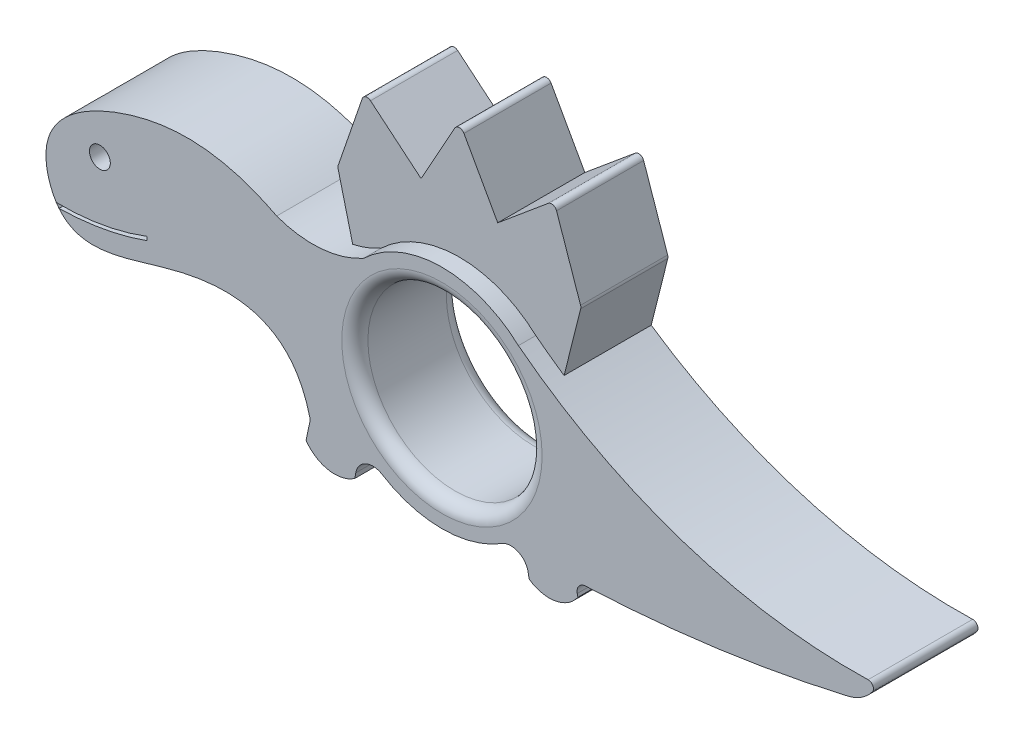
SolidWorks part; units mm, degrees
ref_plane "Front Plane" through (0, 0, 0) normal (0, 0, 1) x (1, 0, 0)
ref_plane "Top Plane" through (0, 0, 0) normal (0, 1, 0) x (1, 0, 0)
ref_plane "Right Plane" through (0, 0, 0) normal (1, 0, 0) x (0, 0, -1)
sketch "Sketch1" plane through (0, 0, 0) normal (0, 0, 1) x (1, 0, 0)
  line L0 (63.5, 0) -> (63.5, 50.8)
  line L1 (0, 0) -> (127, 0)
  line L2 (0, 0) -> (0, 50.8)
  line L3 (0, 50.8) -> (127, 50.8)
  line L4 (127, 0) -> (127, 50.8)
  line L5 (51.6789, 4.9843) -> (50.8, 0)
  line L6 (50.8, 0) -> (43.688, 1.254)
  line L7 (43.688, 1.254) -> (46.9925, 16.7984)
  line L8 (83.312, 1.254) -> (80.0075, 16.7984)
  line L9 (76.2, 0) -> (83.312, 1.254)
  line L10 (75.3211, 4.9843) -> (76.2, 0)
  line L11 (48.7599, 27.0621) -> (46.8931, 33.7412)
  line L12 (46.8931, 33.7412) -> (51.054, 39.5468)
  line L13 (51.054, 39.5468) -> (55.626, 35.5991)
  line L14 (55.626, 35.5991) -> (63.5, 43.3568)
  line L15 (71.374, 35.5991) -> (63.5, 43.3568)
  line L16 (75.946, 39.5468) -> (71.374, 35.5991)
  line L17 (80.1069, 33.7412) -> (75.946, 39.5468)
  line L18 (78.2401, 27.0621) -> (80.1069, 33.7412)
  line L19 (78.2401, 27.0621) -> (78.0058, 26.2235)
  circle A0 centre (63.5, 16.51) radius 12.7
  circle A1 centre (63.5, 16.51) radius 16.51
  arc A2 (43.688, 1.254) -> (50.8, 0) centre (47.8645, 4.146) ccw
  arc A3 (83.312, 1.254) -> (76.2, 0) centre (79.1355, 4.146) cw
  arc A4 (82.907, 3.159) -> (127, 9.509) centre (75.2519, 212.5753) ccw
  arc A5 (72.898, 30.0842) -> (127, 12.049) centre (123.5044, 91.7284) ccw
  arc A6 (52.07, 28.4237) -> (39.4088, 27.432) centre (44.6576, 41.7396) cw
  spline S0 degree 3 poles (44.3028, 4.146) (41.9443, 14.3166) (28.2933, 16.2579) (8.6545, 6.9546) (3.6229, 22.6567) (20.2432, 32.2851) (32.1272, 31.194) (39.4088, 27.432) knots 0 0 0 0 0.277535 0.472766 0.559772 0.733689 1 1 1 1
  dimension "D3" = 25.4
  dimension "D5" = 33.02
  dimension "D11" = 2.002
  dimension "D7" = 7.112
  dimension "D8" = 5.08
  dimension "D12" = 1.905
  dimension "D14" = 79.756
  dimension "D16" = 209.5562
  dimension "D18" = 15.24
  dimension "D1" = 127
  dimension "D2" = 50.8
  dimension "D4" = 16.51
  dimension "D6" = 0
  dimension "D9" = 12.7
  dimension "D10" = 10
  dimension "D13" = 6.35
  dimension "D15" = 2.54
  dimension "D17" = 9.398
  dimension "D19" = 11.43
  dimension "D20" = 12.7
  dimension "D21" = 23.368
  dimension "D22" = 7.874
  dimension "D23" = 8.7329
  dimension "D24" = 4.572
  dimension "D25" = 3.81
extrude "Boss-Extrude1" add sketch "Sketch1" along normal blind 15.24 contours A5 A1 L8 A4 L4 | A5 A1 L0 A0 | A1 L10 L9 L8 | A1 A5 | A3 L1 | A3 L9 L1 | S0 L7 A1 A6 | L0 A1 A0 | A1 L7 L6 L5 | L6 A2 L1 | L1 A2
fillet "Fillet1" radius 2.54 2 edges at (75.3211, 4.9843, 7.62) (51.6789, 4.9843, 7.62)
fillet "Fillet2" radius 1.27 2 edges at (82.907, 3.159, 7.62) (44.3028, 4.146, 7.62)
sketch "Sketch2" plane through (0, 0, 0) normal (0, 0, 1) x (1, 0, 0)
  line L0 (47.9479, 26.859) -> (45.7622, 35.56)
  line L1 (45.7622, 35.56) -> (49.6969, 46.99)
  line L2 (49.6969, 46.99) -> (57.912, 40.1454)
  line L3 (57.912, 40.1454) -> (63.5, 50.165)
  line L4 (63.5, 50.8) -> (63.5, 0)
  line L5 (0, 0) -> (127, 0)
  line L6 (0, 0) -> (0, 50.8)
  line L7 (0, 50.8) -> (127, 50.8)
  line L8 (127, 0) -> (127, 50.8)
  line L9 (79.0521, 26.859) -> (81.2378, 35.56)
  line L10 (81.2378, 35.56) -> (77.3031, 46.99)
  line L11 (77.3031, 46.99) -> (69.088, 40.1454)
  line L12 (69.088, 40.1454) -> (63.5, 50.165)
  line L13 (79.0521, 26.859) -> (78.7621, 25.7046)
  line L16 (47.9479, 26.859) -> (49.6969, 23.7229)
  line L17 (49.6969, 23.7229) -> (63.5, 31.421)
  line L18 (63.5, 31.421) -> (78.2975, 23.1683)
  line L19 (78.2975, 23.1683) -> (78.7621, 25.7046)
  arc A0 (39.4088, 27.432) -> (52.07, 28.4237) centre (44.6576, 41.7396) ccw construction
  arc A1 (74.6465, 28.6893) -> (127, 12.049) centre (123.5044, 91.7284) ccw construction
  dimension "D1" = 127
  dimension "D2" = 5.588
  dimension "D3" = 50.8
  dimension "D4" = 3.81
  dimension "D5" = 3.175
  dimension "D6" = 15.24
extrude "Boss-Extrude4" add sketch "Sketch2" along normal blind 12.7 contours L16 L17 L4 L3 L2 L1 L0 | L18 L19 L13 L9 L10 L11 L12 L4
fillet "Fillet3" radius 0.762 5 edges at (49.6969, 46.99, 6.35) (77.3031, 46.99, 6.35) (63.5, 50.165, 6.35) (45.7622, 35.56, 6.35) (81.2378, 35.56, 6.35)
fillet "Fillet4" radius 6.35 1 edges at (127, 9.509, 7.62)
fillet "Fillet5" radius 0.762 1 edges at (127, 12.049, 7.62)
fillet "Fillet6" radius 1.905 2 edges at (76.2, 16.51, 15.24) (76.2, 16.51, 0)
sketch "Sketch3" plane through (0, 0, 15.24) normal (0, 0, 1) x (1, 0, 0)
  line L0 (20.4994, 14.8613) -> (20.4994, 15.4111)
  line L1 (7.6788, 12.5324) -> (7.2837, 13.0827)
  arc A0 (7.6788, 12.5324) -> (20.4994, 14.8613) centre (7.0451, 52.4731) ccw
  arc A1 (7.2837, 13.0827) -> (20.4994, 15.4111) centre (7.8887, 48.3175) ccw
  circle A2 centre (13.6337, 21.9727) radius 1.5207
  arc A3 (7.2837, 13.0827) -> (7.6788, 12.5324) centre (7.5544, 12.86) ccw
  spline S0 degree 3 poles (44.234, 4.4336) (41.7918, 14.338) (28.2007, 16.2141) (8.6545, 6.9546) (3.6229, 22.6567) (20.2432, 32.2851) (32.1272, 31.194) (39.4088, 27.432) knots 0.002639 0.002639 0.002639 0.002639 0.277535 0.472766 0.559772 0.733689 1 1 1 1 construction
  dimension "D1" = 6.35
  dimension "D2" = 8.89
extrude "Cut-Extrude1" cut sketch "Sketch3" against normal blind 25.4 contours A1 L1 A0 L0 | A3 M7 | A2
